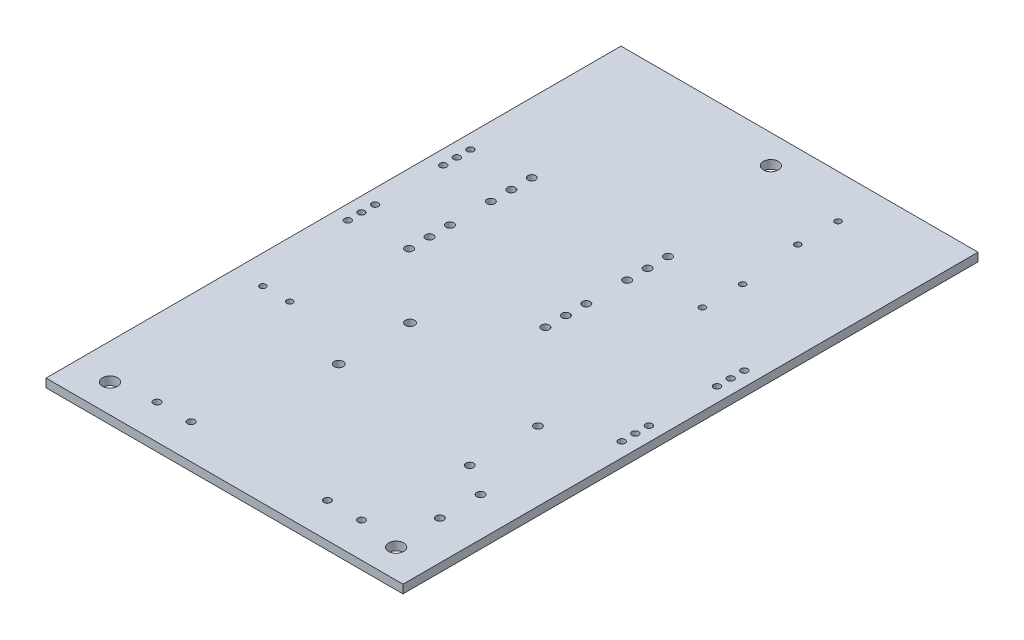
SolidWorks part; units mm, degrees
ref_plane "Front Plane" through (0, 0, 0) normal (0, 0, 1) x (1, 0, 0)
ref_plane "Top Plane" through (0, 0, 0) normal (0, 1, 0) x (1, 0, 0)
ref_plane "Right Plane" through (0, 0, 0) normal (1, 0, 0) x (0, 0, -1)
sketch "Sketch1" plane through (0, 0, 0) normal (0, 1, 0) x (1, 0, 0)
  line L0 (0, 53.594) -> (0, -53.594) construction
  line L1 (-33.274, 53.594) -> (33.274, 53.594)
  line L2 (-33.274, 53.594) -> (-33.274, -53.594)
  line L3 (-33.274, -53.594) -> (33.274, -53.594)
  line L4 (33.274, 53.594) -> (33.274, -53.594)
  dimension "D1" = 66.548
  dimension "D2" = 107.188
extrude "Extrude1" add sketch "Sketch1" along normal blind 1.5748
sketch "Sketch2" plane through (0, 1.5748, 0) normal (0, 1, 0) x (-1, 0, 0)
  line L0 (33.274, 53.594) -> (-33.274, 53.594) construction
  circle A0 centre (26.67, 48.26) radius 1.397
  circle A1 centre (-26.67, 48.26) radius 1.397
  circle A2 centre (0, -48.26) radius 1.397
  point P8 (0, 53.594)
  point P9 (0, 53.594)
  dimension "D4" = 2.794
  dimension "D1" = 5.334
  dimension "D2" = 26.67
  dimension "D3" = 26.67
  dimension "D5" = 96.52
extrude "MtgHoles" cut sketch "Sketch2" against normal through all
sketch "Sketch3" plane through (0, 1.5748, 0) normal (0, 1, 0) x (-1, 0, 0)
  line L0 (33.274, 53.594) -> (-33.274, 53.594) construction
  line L1 (33.274, 53.594) -> (-33.274, 53.594) construction
  line L2 (0, 53.594) -> (0, 39.7132) construction
  circle A0 centre (-19.05, 47.117) radius 0.6604
  circle A1 centre (-12.7, 47.117) radius 0.6604
  circle A2 centre (12.7, 47.117) radius 0.6604
  circle A3 centre (19.05, 47.117) radius 0.6604
  point P7 (0, 53.594)
  dimension "D1" = 1.3208
  dimension "D2" = 6.477
  dimension "D3" = 12.7
  dimension "D4" = 6.35
extrude "TerminalBlockHoles" cut sketch "Sketch3" against normal through all
sketch "Sketch4" plane through (0, 1.5748, 0) normal (0, 1, 0) x (-1, 0, 0)
  line L0 (-33.274, 53.594) -> (-33.274, -53.594) construction
  line L1 (33.274, -53.594) -> (33.274, 53.594) construction
  line L2 (33.274, 53.594) -> (-33.274, 53.594) construction
  circle A0 centre (-30.607, 10.16) radius 0.6223
  circle A1 centre (-30.607, 5.08) radius 0.6223
  circle A2 centre (-30.607, 7.62) radius 0.6223
  circle A3 centre (-30.607, -7.62) radius 0.6223
  circle A4 centre (-30.607, -12.7) radius 0.6223
  circle A5 centre (-30.607, -10.16) radius 0.6223
  circle A6 centre (30.607, 0) radius 0.6223
  circle A7 centre (30.607, -5.08) radius 0.6223
  circle A8 centre (30.607, -2.54) radius 0.6223
  circle A9 centre (30.607, -17.78) radius 0.6223
  circle A10 centre (30.607, -22.86) radius 0.6223
  circle A11 centre (30.607, -20.32) radius 0.6223
  dimension "D1" = 1.2446
  dimension "D2" = 2.667
  dimension "D3" = 43.434
  dimension "D4" = 2.54
  dimension "D5" = 2.54
  dimension "D6" = 2.54
  dimension "D7" = 2.54
  dimension "D8" = 12.7
  dimension "D9" = 2.54
  dimension "D10" = 2.54
  dimension "D11" = 12.7
  dimension "D12" = 2.54
  dimension "D13" = 2.54
  dimension "D14" = 2.667
  dimension "D15" = 53.594
extrude "MosfetHoles" cut sketch "Sketch4" against normal through all
sketch "Sketch5" plane through (0, 1.5748, 0) normal (0, 1, 0) x (1, 0, 0)
  line L0 (-33.274, -53.594) -> (33.274, -53.594) construction
  line L3 (0, -53.594) -> (0, 24.9941) construction
  circle A0 centre (-20.32, 24.003) radius 0.7239
  circle A1 centre (-20.32, 20.193) radius 0.7239
  circle A2 centre (-20.32, 16.383) radius 0.7239
  circle A3 centre (-20.32, 8.763) radius 0.7239
  circle A4 centre (-20.32, 4.953) radius 0.7239
  circle A5 centre (-20.32, 1.143) radius 0.7239
  circle A6 centre (5.08, 24.003) radius 0.7239
  circle A7 centre (5.08, 20.193) radius 0.7239
  circle A8 centre (5.08, 16.383) radius 0.7239
  circle A9 centre (5.08, 8.763) radius 0.7239
  circle A10 centre (5.08, 4.953) radius 0.7239
  circle A11 centre (5.08, 1.143) radius 0.7239
  dimension "D1" = 1.4478
  dimension "D2" = 77.597
  dimension "D3" = 20.32
  dimension "D4" = 3.81
  dimension "D5" = 3.81
  dimension "D6" = 7.62
  dimension "D7" = 3.81
  dimension "D8" = 3.81
  dimension "D10" = 25.4
  dimension "D9" = 2
extrude "Transformer" cut sketch "Sketch5" against normal through all
sketch "Sketch6" plane through (0, 1.5748, 0) normal (0, 1, 0) x (1, 0, 0)
  line L0 (0, -53.594) -> (0, 35.0286) construction
  line L1 (-33.274, -53.594) -> (33.274, -53.594) construction
  circle A0 centre (16.51, 18.983) radius 0.5715
  circle A1 centre (16.51, 26.483) radius 0.5715
  circle A2 centre (15.24, 38.033) radius 0.5715
  circle A3 centre (15.24, 45.533) radius 0.5715
  circle A4 centre (-27.9, -18.542) radius 0.5715
  circle A5 centre (-22.9, -18.542) radius 0.5715
  dimension "D1" = 1.143
  dimension "D8" = 1.143
  dimension "D2" = 16.51
  dimension "D3" = 72.577
  dimension "D4" = 7.5
  dimension "D5" = 15.24
  dimension "D6" = 91.627
  dimension "D7" = 7.5
  dimension "D9" = 27.9
  dimension "D10" = 35.052
  dimension "D11" = 5
extrude "Capacitors" cut sketch "Sketch6" against normal through all
sketch "Sketch8" plane through (0, 1.5748, 0) normal (0, 1, 0) x (1, 0, 0)
  line L0 (-33.274, -53.594) -> (33.274, -53.594) construction
  circle A0 centre (20.32, -28.194) radius 0.7239
  circle A1 centre (20.32, -15.494) radius 0.7239
  circle A2 centre (26.035, -39.497) radius 0.7239
  circle A3 centre (26.035, -31.877) radius 0.7239
  circle A4 centre (-8.255, -24.049) radius 0.8509
  circle A5 centre (-8.255, -10.749) radius 0.8509
  point P4 (0, -53.594)
  point P11 (0, -53.594)
  point P16 (0, -53.594)
  dimension "D1" = 1.4478
  dimension "D8" = 1.7018
  dimension "D2" = 25.4
  dimension "D3" = 20.32
  dimension "D4" = 12.7
  dimension "D5" = 14.097
  dimension "D6" = 7.62
  dimension "D7" = 26.035
  dimension "D9" = 29.545
  dimension "D10" = 8.255
  dimension "D11" = 13.3
extrude "Cut-Extrude3" cut sketch "Sketch8" against normal through all
